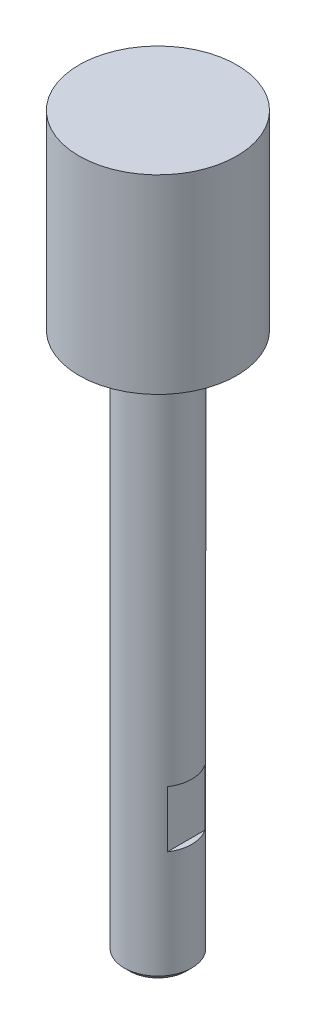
SolidWorks part; units mm, degrees
ref_plane "Front" through (0, 0, 0) normal (0, 0, 1) x (1, 0, 0)
ref_plane "Top" through (0, 0, 0) normal (0, 1, 0) x (1, 0, 0)
ref_plane "Right" through (0, 0, 0) normal (1, 0, 0) x (0, 0, -1)
sketch "Sketch1" plane through (0, 0, 0) normal (0, 1, 0) x (1, 0, 0)
  circle A0 centre (0, 0) radius 11.1125
  dimension "D1" = 22.225
extrude "Piston" add sketch "Sketch1" along normal blind 26.7716
sketch "Sketch2" plane through (0, 0, 0) normal (0, -1, 0) x (1, 0, 0)
  circle A0 centre (0, 0) radius 4.7625
  dimension "D1" = 9.525
extrude "Rod" add sketch "Sketch2" along normal blind 76.2
sketch "Sketch3" plane through (0, 0, 0) normal (0, 0, 1) x (1, 0, 0)
  line L0 (0, 0) -> (0, -22.1578) construction
  line L1 (0, 26.7716) -> (0, 0) construction
  line L2 (-3.9675, -52.3875) -> (-3.9675, -60.325)
  line L3 (3.9675, -52.3875) -> (10.1838, -52.3875)
  line L4 (3.9675, -52.3875) -> (3.9675, -60.325)
  line L5 (3.9675, -60.325) -> (10.1838, -60.325)
  line L6 (10.1838, -52.3875) -> (10.1838, -60.325)
  line L7 (-3.9675, -52.3875) -> (-10.1838, -52.3875)
  line L8 (-10.1838, -52.3875) -> (-10.1838, -60.325)
  line L9 (-3.9675, -60.325) -> (-10.1838, -60.325)
  line L10 (-4.7625, -76.2) -> (4.7625, -76.2) construction
  dimension "D1" = 23.8125
  dimension "D2" = 3.9675
  dimension "D3" = 7.9375
extrude "WrenchFlat" cut sketch "Sketch3" against normal blind 13.937 and the other way blind 13.1496
chamfer "Chamfer1" distance 0.7874 angle 45 1 edges at (0, -76.2, -4.7625)
